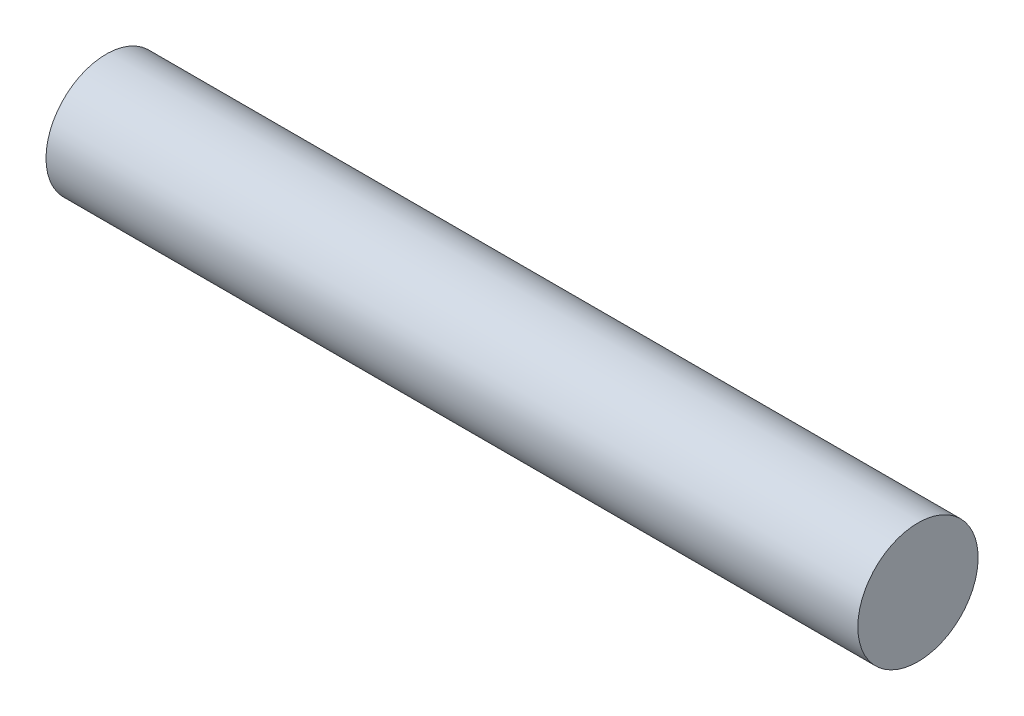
SolidWorks part; units mm, degrees
ref_plane "Front Plane" through (0, 0, 0) normal (0, 0, 1) x (1, 0, 0)
ref_plane "Top Plane" through (0, 0, 0) normal (0, 1, 0) x (1, 0, 0)
ref_plane "Right Plane" through (0, 0, 0) normal (1, 0, 0) x (0, 0, -1)
sketch "Sketch1" plane through (0, 0, 0) normal (0, 0, 1) x (1, 0, 0)
  line L0 (0, 0) -> (0, 2)
  line L1 (0, 2) -> (27, 2)
  line L2 (27, 2) -> (27, 0)
  line L3 (27, 0) -> (0, 0)
  line L4 (27, 0) -> (0, 0) construction
revolve "Revolve1" add sketch "Sketch1" angle 360 about L4
ref_plane "Plane1" through (11.9048, 0, 0) normal (1, 0, 0) x (0, 0, -1)
ref_plane "Plane2" through (1.1905, 0, 0) normal (1, 0, 0) x (0, 0, -1)
ref_plane "Plane3" through (0, 0, 0) normal (1, 0, 0) x (0, 0, -1)
ref_plane "Plane4" through (0, 0, 0) normal (1, 0, 0) x (0, 0, -1)
ref_plane "Plane5" through (27, 0, 0) normal (1, 0, 0) x (0, 0, -1)
ref_plane "Plane6" through (27, 0, 0) normal (1, 0, 0) x (0, 0, -1)
ref_plane "Plane7" through (0.9, 0, 0) normal (1, 0, 0) x (0, 0, -1)
ref_plane "Plane8" through (20, 0, 0) normal (1, 0, 0) x (0, 0, -1)
ref_plane "Plane9" through (0, 0, 0) normal (1, 0, 0) x (0, 0, -1)
ref_plane "Plane10" through (27, 0, 0) normal (1, 0, 0) x (0, 0, -1)
ref_plane "Plane11" through (41, 0, 0) normal (1, 0, 0) x (0, 0, -1)
ref_plane "Plane12" through (27, 0, 0) normal (1, 0, 0) x (0, 0, -1)
ref_plane "Plane13" through (30, 0, 0) normal (1, 0, 0) x (0, 0, -1)
ref_plane "Plane14" through (13.5, 0, 0) normal (1, 0, 0) x (0, 0, -1)
